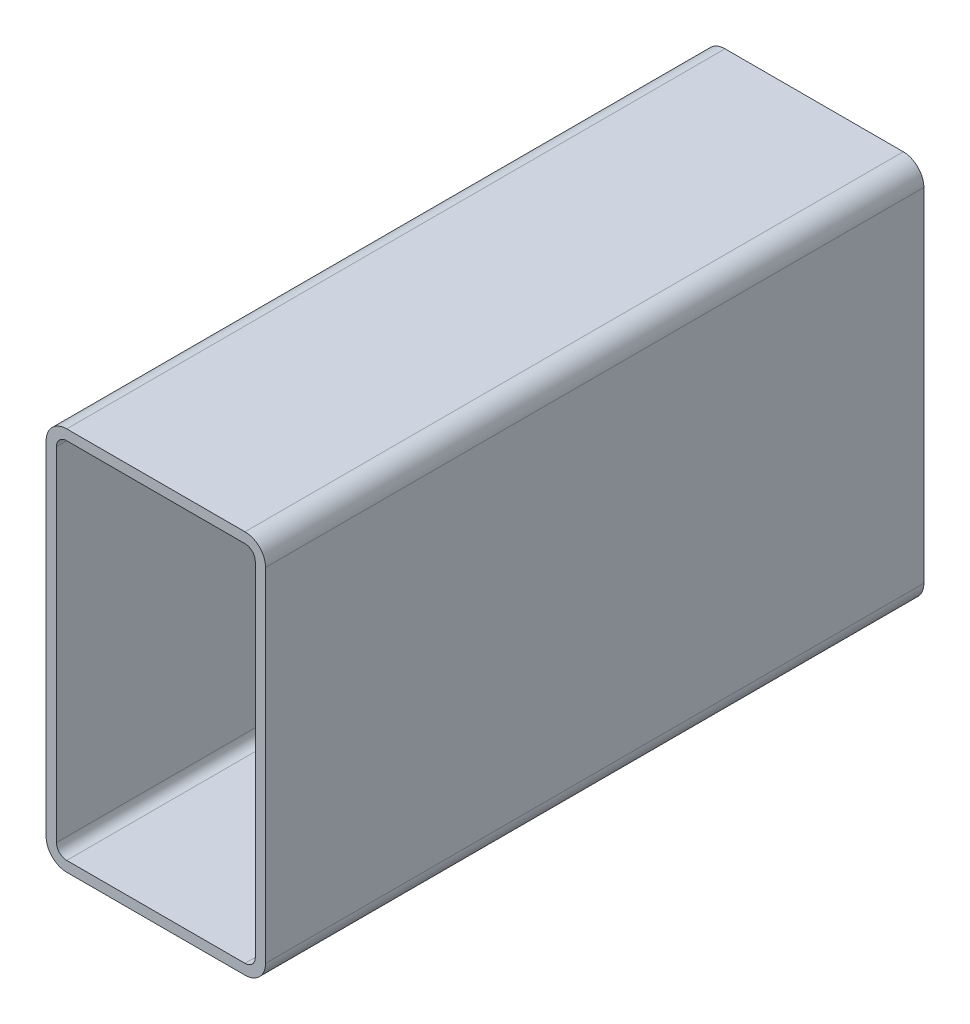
SolidWorks part; units mm, degrees
ref_plane "Front Plane" through (0, 0, 0) normal (0, 0, 1) x (1, 0, 0)
ref_plane "Top Plane" through (0, 0, 0) normal (0, 1, 0) x (1, 0, 0)
ref_plane "Right Plane" through (0, 0, 0) normal (1, 0, 0) x (0, 0, -1)
sketch "Sketch1" plane through (0, 0, 0) normal (0, 0, 1) x (1, 0, 0)
sketch_block_instance "HSS7x4x0.1875-1"
sketch_block "HSS7x4x0.1875"
extrude "Boss-Extrude1" add sketch "Sketch1" along normal blind 304.8
